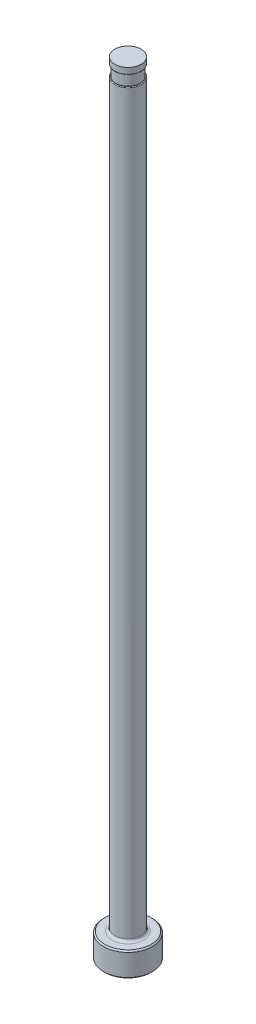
SolidWorks part; units mm, degrees
ref_plane "Front Plane" through (0, 0, 0) normal (0, 0, 1) x (1, 0, 0)
ref_plane "Top Plane" through (0, 0, 0) normal (0, 1, 0) x (1, 0, 0)
ref_plane "Right Plane" through (0, 0, 0) normal (1, 0, 0) x (0, 0, -1)
other "Configuration Table"
sketch "Sketch1" plane through (0, 0, 0) normal (0, 0, 1) x (1, 0, 0)
  line L0 (0, 259.9588) -> (0, -15.1925) construction
  line L1 (0, 0) -> (-4.7625, 0)
  line L2 (-4.7625, 0) -> (-4.7625, 4.7498)
  line L3 (-4.7625, 4.7498) -> (-2.5794, 4.7498)
  line L4 (-2.5794, 4.7498) -> (-2.5794, 152.4)
  line L5 (-2.5794, 152.4) -> (0, 152.4)
  line L6 (0, 152.4) -> (0, 0)
  dimension "L" = 152.4
  dimension "H" = 9.525
  dimension "T" = 4.7498
  dimension "D" = 5.1587
revolve "Revolve1" add sketch "Sketch1" angle 360 about L0
chamfer "Chamfer1" distance 0.254 angle 45 2 edges at (0, 4.7498, 4.7625) (0, 0, 4.7625)
fillet "Fillet1" radius 0.508 1 edges at (0, 4.7498, 2.5794)
sketch "Sketch2" plane through (0, 0, 0) normal (0, 0, 1) x (1, 0, 0)
  line L0 (-2.5794, 152.4) -> (-2.5794, 5.2578) construction
  line L1 (-2.5794, 151.13) -> (-2.3762, 151.13)
  line L2 (-2.5794, 151.13) -> (-2.5794, 149.098)
  line L3 (-2.5794, 149.098) -> (-2.3762, 149.098)
  line L4 (-2.3762, 151.13) -> (-2.3762, 149.098)
  line L5 (2.5794, 152.4) -> (-2.5794, 152.4) construction
  line L6 (0, 153.4483) -> (0, 147.3282) construction
  dimension "D1" = 2.032
  dimension "N" = 1.27
  dimension "FD" = 0.2032
  dimension "D3" = 4.7523
revolve "Vent Relief" cut sketch "Sketch2" angle 360 about L6
sketch "Sketch3" plane through (0, 0, 0) normal (0, 0, 1) x (1, 0, 0)
  line L0 (-2.3762, 150.114) -> (-2.3762, 86.614)
  line L1 (-2.3762, 151.13) -> (-2.3762, 149.098) construction
  line L2 (-2.5794, 149.098) -> (-2.5794, 5.2578) construction
  line L3 (-2.5794, 85.4964) -> (-2.5794, 150.114)
  line L4 (-2.5794, 150.114) -> (-2.3762, 150.114)
  arc A0 (-2.3762, 86.614) -> (-2.5794, 85.4964) centre (-5.5512, 86.614) cw
  dimension "D1" = 3.175
  dimension "D2" = 63.5
extrude "D-Slot" cut sketch "Sketch3" against normal through all both and the other way through all
sketch "Sketch5" plane through (0, 0, 0) normal (0, 0, 1) x (1, 0, 0)
  line L0 (-2.5794, 151.13) -> (2.5794, 151.13) construction
  line L1 (-2.5794, 152.4) -> (-2.5603, 152.4)
  line L2 (-2.5794, 152.4) -> (-2.5794, 151.13)
  line L3 (-2.5794, 151.13) -> (-2.5603, 151.13)
  line L4 (-2.5603, 152.4) -> (-2.5603, 151.13)
  line L5 (0, 152.6877) -> (0, 150.5771) construction
  dimension "VP" = 0.019
revolve "Vent Diameter" cut sketch "Sketch5" angle 360 about L5
fillet "Fillet2" radius 0.127 2 edges at (2.5794, 149.098, 0) (0, 151.13, 2.5603)
sketch "Pocket Sketch" plane through (0, 0, 0) normal (0, 0, 1) x (1, 0, 0)
  line L0 (-5.1594, 0) -> (-5.1594, 4.7752)
  line L1 (-5.1594, 4.7752) -> (-3.5398, 4.7752)
  line L2 (-2.7778, 5.5372) -> (-2.7778, 22.225)
  line L3 (-2.7778, 22.225) -> (0, 22.225)
  line L4 (0, 22.225) -> (0, 0)
  line L5 (0, 0) -> (-5.1594, 0)
  line L6 (0, 12.6104) -> (0, -2.4989) construction
  line L7 (-4.7625, 4.4958) -> (-4.7625, 0.254) construction
  line L8 (4.5085, 4.7498) -> (-4.5085, 4.7498) construction
  line L9 (-2.5794, 85.4964) -> (-2.5794, 5.2578) construction
  line L10 (-3.5398, 4.7752) -> (-2.7778, 5.5372)
  point P3 (-2.7778, 4.7752)
  dimension "D1" = 10.3187
  dimension "D2" = 0.3969
  dimension "D3" = 0.0254
  dimension "D4" = 0.1984
  dimension "D5" = 5.5556
  dimension "D6" = 22.225
